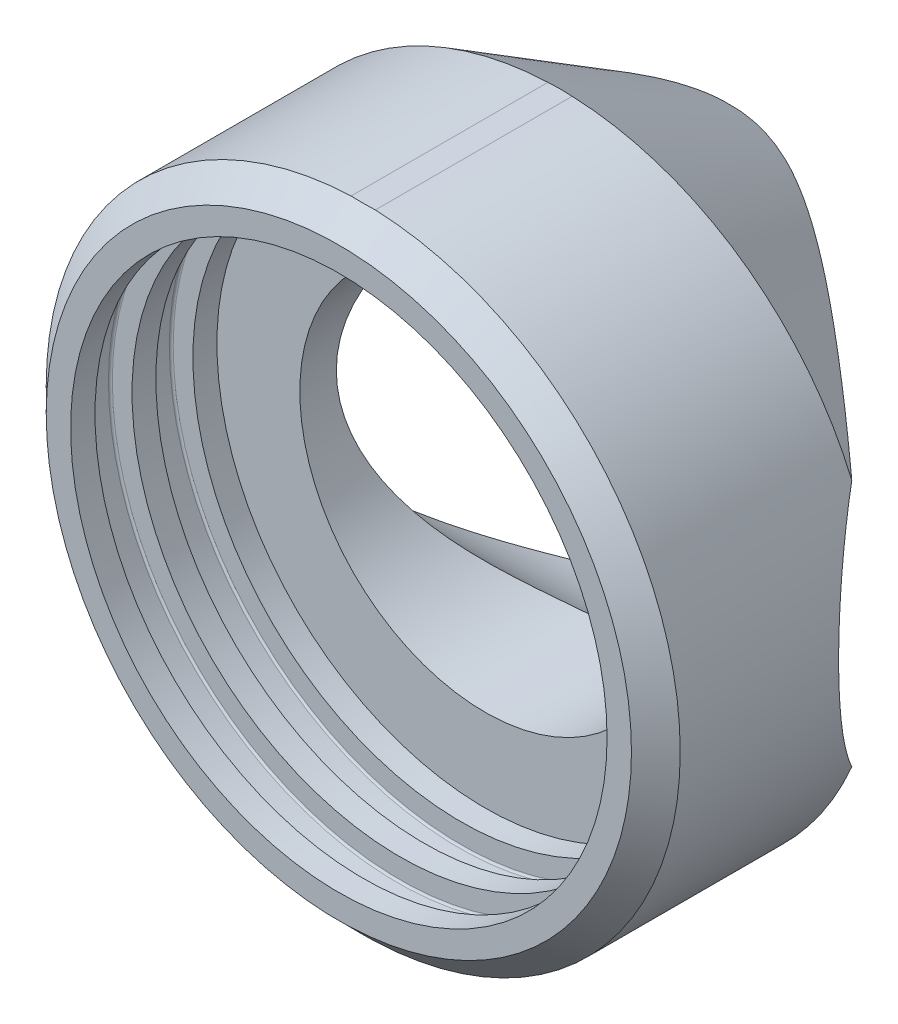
SolidWorks part; units mm, degrees
ref_plane "Front Plane" through (0, 0, 0) normal (0, 0, 1) x (1, 0, 0)
ref_plane "Top Plane" through (0, 0, 0) normal (0, 1, 0) x (1, 0, 0)
ref_plane "Right Plane" through (0, 0, 0) normal (1, 0, 0) x (0, 0, -1)
sketch "Sketch1" plane through (0, 0, 0) normal (0, 0, 1) x (1, 0, 0)
  circle A0 centre (0, 0) radius 41.275
  dimension "D1" = 82.55
extrude "Boss-Extrude1" add sketch "Sketch1" against normal blind 50.8
sketch "Sketch2" plane through (0, 0, 0) normal (0, 0, 1) x (1, 0, 0)
  circle A0 centre (0, 0) radius 14.2875
  dimension "D1" = 28.575
extrude "Cut-Extrude1" cut sketch "Sketch2" against normal blind 50.8
sketch "Sketch3" plane through (0, 0, 0) normal (0, 0, 1) x (1, 0, 0)
  circle A0 centre (0, 0) radius 34.925
  dimension "D1" = 69.85
extrude "Cut-Extrude2" cut sketch "Sketch3" against normal blind 19.05
sketch "Sketch4" plane through (0, 0, -19.05) normal (0, 0, 1) x (1, 0, 0)
  circle A0 centre (0, 0) radius 24.13
  dimension "D1" = 48.26
extrude "Cut-Extrude3" cut sketch "Sketch4" against normal through all
sketch "Sketch5" plane through (0, 0, 0) normal (1, 0, 0) x (0, 0, -1)
  circle A0 centre (52.3748, 0) radius 28.575
  dimension "D1" = 57.15
  dimension "D2" = 52.3748
extrude "Cut-Extrude6" cut sketch "Sketch5" against normal through all both and the other way through all
chamfer "Chamfer1" distance 12.7 angle 60 4 edges at (0, 41.275, -50.8) (0, -41.275, -50.8) (41.2678, -0.7731, -23.8103) (-41.2678, 0.7731, -23.8103)
chamfer "Chamfer2" distance 3.175 angle 45 1 edges at (41.275, 0, 0)
sketch "Sketch6" plane through (0, 0, 0) normal (0, 0, 1) x (1, 0, 0)
  circle A0 centre (0, 0) radius 37.7444
  dimension "D1" = 75.4888
extrude "Cut-Extrude7" cut sketch "Sketch6" against normal blind 4.826 from offset 11.0998
sketch "Sketch7" plane through (0, 0, 0) normal (0, 0, 1) x (1, 0, 0)
  circle A0 centre (0, 0) radius 37.7444
  dimension "D1" = 75.4888
extrude "Cut-Extrude8" cut sketch "Sketch7" against normal blind 4.826 from offset 3.175
fillet "Fillet1" radius 0.254 4 edges at (37.7444, 0, -11.0998) (37.7444, 0, -3.175) (37.7444, 0, -8.001) (37.7444, 0, -15.9258)
sketch "Sketch8" plane through (0, 0, 0) normal (0, 0, 1) x (1, 0, 0)
  line L0 (-1.5748, 41.2449) -> (1.5748, 41.2449)
  circle A0 centre (0, 0) radius 41.275 construction
  dimension "D1" = 1.5748
extrude "Cut-Extrude9" cut sketch "Sketch8" against normal through all and the other way through all
sketch "Sketch9" plane through (0, 0, 0) normal (0, 0, 1) x (1, 0, 0)
  line L0 (-1.5748, -41.2449) -> (1.5748, -41.2449)
  arc A0 (-1.5748, 41.2449) -> (1.5748, 41.2449) centre (0, 0) ccw construction
  dimension "D1" = 1.5748
extrude "Cut-Extrude10" cut sketch "Sketch9" against normal through all and the other way through all flip side to cut
